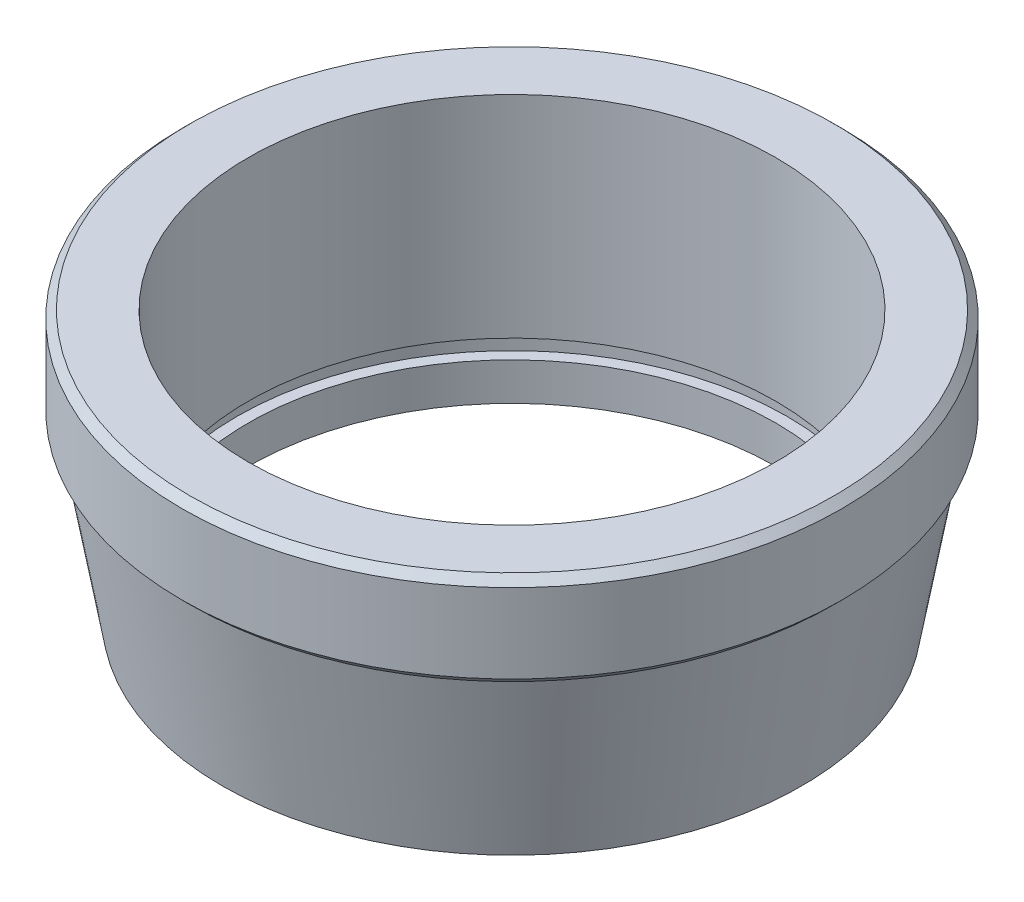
SolidWorks part; units mm, degrees
ref_plane "Přední rovina" through (0, 0, 0) normal (0, 0, 1) x (1, 0, 0)
ref_plane "Horní rovina" through (0, 0, 0) normal (0, 1, 0) x (1, 0, 0)
ref_plane "Pravá rovina" through (0, 0, 0) normal (1, 0, 0) x (0, 0, -1)
sketch "Skica1" plane through (0, 0, 0) normal (0, 1, 0) x (1, 0, 0)
  circle A0 centre (0, 0) radius 8.5
extrude "Přidat vysunutím1" add sketch "Skica1" against normal blind 4.6 draft 10
sketch "Skica2" plane through (0, 0, 0) normal (0, 1, 0) x (-1, 0, 0)
  circle A0 centre (0, 0) radius 8.75
extrude "Přidat vysunutím2" add sketch "Skica2" along normal blind 2.5
chamfer "Zkosení1" distance 0.2 angle 45 2 edges at (0, 0, 8.75) (0, 2.5, 8.75)
sketch "Skica3" plane through (0, 2.5, 0) normal (0, 1, 0) x (1, 0, 0)
  circle A0 centre (0, 0) radius 7
extrude "Odebrat vysunutím1" cut sketch "Skica3" against normal blind 2.5
sketch "Skica4" plane through (0, -4.6, 0) normal (0, -1, 0) x (1, 0, 0)
  circle A0 centre (0, 0) radius 7
extrude "Odebrat vysunutím2" cut sketch "Skica4" against normal up to surface (4.6 mm away)
sketch "Skica5" plane through (0, 0, 0) normal (0, 0, 1) x (1, 0, 0)
  line L0 (-7.6889, -4.6) -> (7.6889, -4.6) construction
  line L1 (-7.3, -3.6) -> (-7, -3.6)
  line L2 (-7.3, -3.6) -> (-7.3, -3.1)
  line L3 (-7.3, -3.1) -> (-7, -3.1)
  line L4 (-7, -3.6) -> (-7, -3.1)
  line L5 (-7, -4.6) -> (7, -4.6) construction
  point P8 (-3.25, -4.6)
  dimension "D1" = 0.3
  dimension "D2" = 0.5
  dimension "D3" = 1
  dimension "D5" = 7.3
ref_axis "Osa1" through (0, 2.5, 0) along (0, -1, 0)
revolve "Odebrat rotací1" cut sketch "Skica5" angle 360 about axis through (0, 2.5, 0) along (0, -1, 0)
